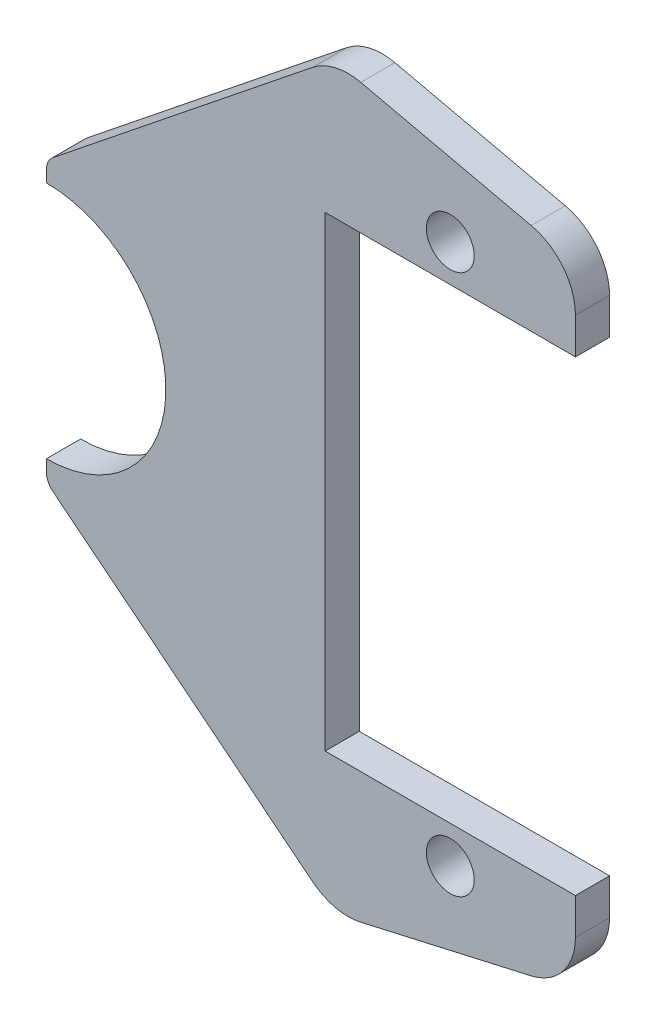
SolidWorks part; units mm, degrees
ref_plane "Plan de face" through (0, 0, 0) normal (0, 0, 1) x (1, 0, 0)
ref_plane "Plan de dessus" through (0, 0, 0) normal (0, 1, 0) x (1, 0, 0)
ref_plane "Plan de droite" through (0, 0, 0) normal (1, 0, 0) x (0, 0, -1)
sketch "Esquisse1" plane through (0, 0, 0) normal (0, 0, 1) x (1, 0, 0)
  line L0 (49, -41) -> (49, 41)
  line L1 (49, 41) -> (93, 41)
  line L2 (93, 41) -> (93, 47.3732)
  line L3 (85.2155, 57.1247) -> (55.2558, 63.9314)
  line L4 (46.7879, 61.9842) -> (1.1243, 25.4007)
  line L5 (0, 23.0594) -> (0, 21)
  line L6 (0, 0) -> (49, 0) construction
  line L7 (0, -23.0594) -> (0, -21)
  line L8 (46.7879, -61.9842) -> (1.1243, -25.4007)
  line L9 (85.2155, -57.1247) -> (55.2558, -63.9314)
  line L10 (93, -41) -> (93, -47.3732)
  line L11 (49, -41) -> (93, -41)
  arc A0 (0, 21) -> (0, -21) centre (0, 0) cw
  arc A1 (85.2155, 57.1247) -> (93, 47.3732) centre (83, 47.3732) cw
  arc A2 (46.7879, 61.9842) -> (55.2558, 63.9314) centre (53.0403, 54.1799) cw
  arc A3 (1.1243, 25.4007) -> (0, 23.0594) centre (3, 23.0594) ccw
  circle A4 centre (71, 47.5) radius 4.2
  circle A5 centre (71, -47.5) radius 4.2
  arc A6 (1.1243, -25.4007) -> (0, -23.0594) centre (3, -23.0594) cw
  arc A7 (46.7879, -61.9842) -> (55.2558, -63.9314) centre (53.0403, -54.1799) ccw
  arc A8 (85.2155, -57.1247) -> (93, -47.3732) centre (83, -47.3732) ccw
  point P14 (50.5523, 65)
  point P17 (0, 24.5)
  point P33 (0, -24.5)
  point P34 (50.5523, -65)
  dimension "D1" = 21
  dimension "D9" = 10
  dimension "D10" = 3
  dimension "D11" = 8.4
  dimension "D2" = 82
  dimension "D3" = 44
  dimension "D4" = 130
  dimension "D5" = 141.3
  dimension "D6" = 12.8
  dimension "D7" = 93
  dimension "D8" = 24.5
  dimension "D12" = 95
  dimension "D13" = 22
extrude "Extrusion1" add sketch "Esquisse1" along normal blind 6
